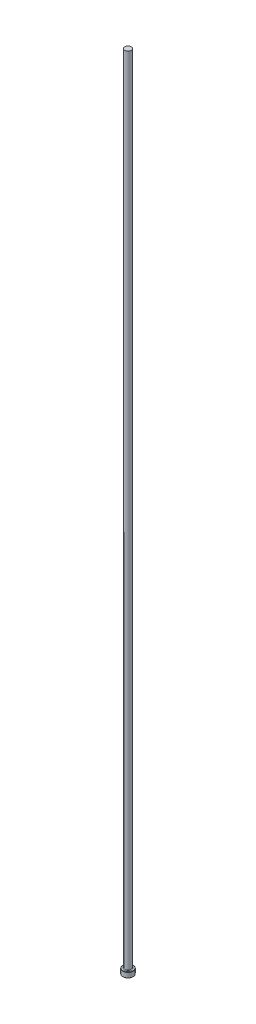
SolidWorks part; units mm, degrees
ref_plane "Front Plane" through (0, 0, 0) normal (0, 0, 1) x (1, 0, 0)
ref_plane "Top Plane" through (0, 0, 0) normal (0, 1, 0) x (1, 0, 0)
ref_plane "Right Plane" through (0, 0, 0) normal (1, 0, 0) x (0, 0, -1)
sketch "Sketch1" plane through (0, 0, 0) normal (0, 0, 1) x (1, 0, 0)
  line L0 (0, 259.9588) -> (0, -15.1925) construction
  line L1 (0, 0) -> (-6.35, 0)
  line L2 (-6.35, 0) -> (-6.35, 6.35)
  line L3 (-6.35, 6.35) -> (-3.9687, 6.35)
  line L4 (-3.9687, 6.35) -> (-3.9687, 990.6)
  line L5 (-3.9687, 990.6) -> (0, 990.6)
  line L6 (0, 990.6) -> (0, 0)
  dimension "L" = 990.6
  dimension "H" = 12.7
  dimension "T" = 6.35
  dimension "D" = 7.9375
revolve "Revolve1" add sketch "Sketch1" angle 360 about L0
chamfer "Chamfer1" distance 0.254 angle 45 2 edges at (0, 6.35, 6.35) (0, 0, 6.35)
fillet "Fillet1" radius 0.762 1 edges at (0, 6.35, 3.9687)
sketch "Pocket Sketch" plane through (0, 0, 0) normal (0, 0, 1) x (1, 0, 0)
  line L0 (-6.7469, 0) -> (-6.7469, 6.3754)
  line L1 (-6.7469, 6.3754) -> (-5.1276, 6.3754)
  line L2 (-4.3656, 7.1374) -> (-4.3656, 22.225)
  line L3 (-4.3656, 22.225) -> (0, 22.225)
  line L4 (0, 22.225) -> (0, 0)
  line L5 (0, 0) -> (-6.7469, 0)
  line L6 (0, 12.6104) -> (0, -2.4989) construction
  line L7 (-6.35, 6.096) -> (-6.35, 0.254) construction
  line L8 (6.096, 6.35) -> (-6.096, 6.35) construction
  line L9 (-3.9687, 990.6) -> (-3.9687, 7.112) construction
  line L10 (-5.1276, 6.3754) -> (-4.3656, 7.1374)
  point P3 (-4.3656, 6.3754)
  dimension "D1" = 13.4937
  dimension "D2" = 0.3969
  dimension "D3" = 0.0254
  dimension "D4" = 0.3969
  dimension "D5" = 8.7312
  dimension "D6" = 22.225
